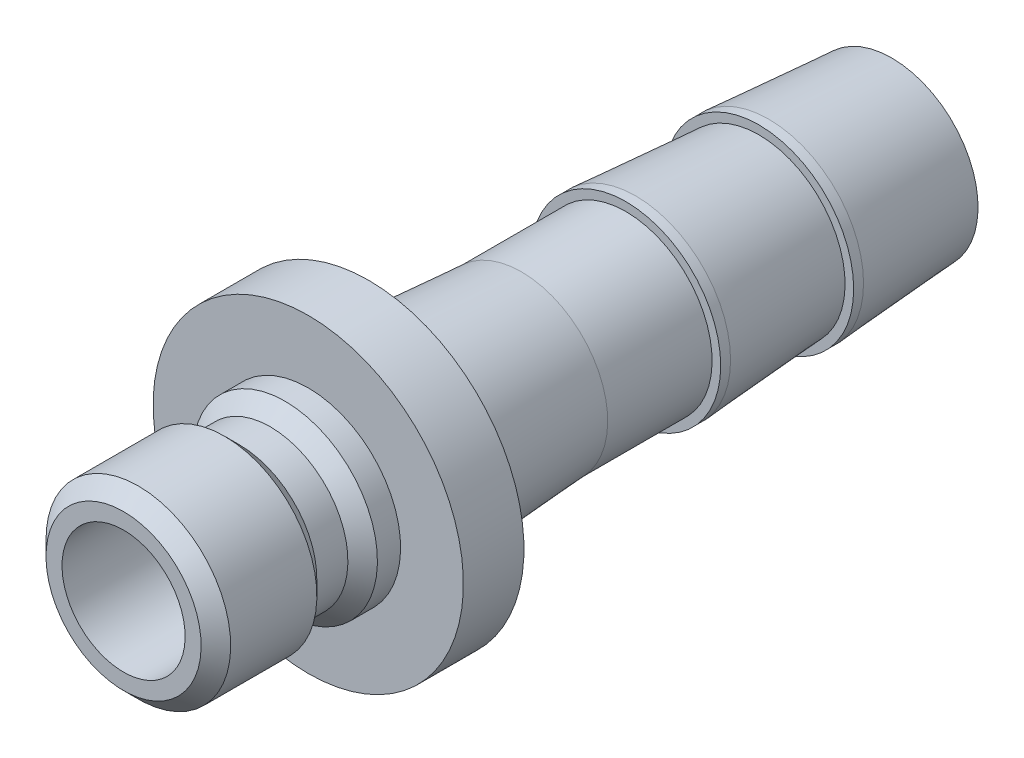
SolidWorks part; units mm, degrees
ref_plane "Front Plane" through (0, 0, 0) normal (0, 0, 1) x (1, 0, 0)
ref_plane "Top Plane" through (0, 0, 0) normal (0, 1, 0) x (1, 0, 0)
ref_plane "Right Plane" through (0, 0, 0) normal (1, 0, 0) x (0, 0, -1)
sketch "Sketch1" plane through (0, 0, 0) normal (1, 0, 0) x (0, 0, -1)
  line L0 (0, 0) -> (-12.7, 0) construction
  line L1 (-9.525, 3.175) -> (-9.525, 4.0005)
  line L2 (-3.556, 4.0005) -> (-3.556, 0) construction
  line L3 (-8.763, 4.7625) -> (-4.318, 4.7625)
  line L4 (0, 8.001) -> (0, 0) construction
  line L5 (-3.556, 4.0005) -> (-1.9558, 4.0005)
  line L6 (-1.1938, 4.7625) -> (0, 4.7625)
  line L7 (0, 4.7625) -> (0, 8.001)
  line L8 (-3.556, 4.0005) -> (-4.318, 4.7625)
  line L9 (-1.9558, 4.0005) -> (-1.1938, 4.7625)
  line L10 (-9.525, 4.0005) -> (-8.763, 4.7625)
  line L11 (-9.525, 3.175) -> (30.099, 3.175)
  line L12 (0, 8.001) -> (3.1242, 8.001)
  line L13 (3.1242, 8.001) -> (3.1242, 4.8895)
  line L14 (3.1242, 4.8895) -> (4.6482, 4.8895)
  line L15 (0, 0) -> (28.0489, 0) construction
  line L16 (4.6482, 4.8895) -> (10.9982, 4.445)
  line L17 (23.749, 4.8895) -> (23.241, 4.8895)
  line L18 (10.9982, 4.445) -> (16.383, 4.445)
  line L20 (16.891, 4.8895) -> (23.241, 4.445)
  line L22 (23.749, 4.8895) -> (30.099, 4.445)
  line L23 (30.099, 4.445) -> (30.099, 3.175)
  line L24 (23.241, 4.8895) -> (23.241, 4.445)
  line L25 (16.891, 4.8895) -> (16.383, 4.8895)
  line L26 (16.383, 4.8895) -> (16.383, 4.445)
  dimension "D1" = 9.525
  dimension "D2" = 1.6002
  dimension "D3" = 0.762
  dimension "D4" = 45
  dimension "D5" = 5.969
  dimension "D6" = 45
  dimension "D7" = 39.624
  dimension "D8" = 26.9748
  dimension "D9" = 16.002
  dimension "D11" = 9.779
  dimension "D12" = 6.35
  dimension "D13" = 6.35
  dimension "D14" = 9.525
  dimension "D15" = 0.508
  dimension "D16" = 1.524
  dimension "D17" = 8.89
revolve "Revolve1" add sketch "Sketch1" angle 360 about L0
